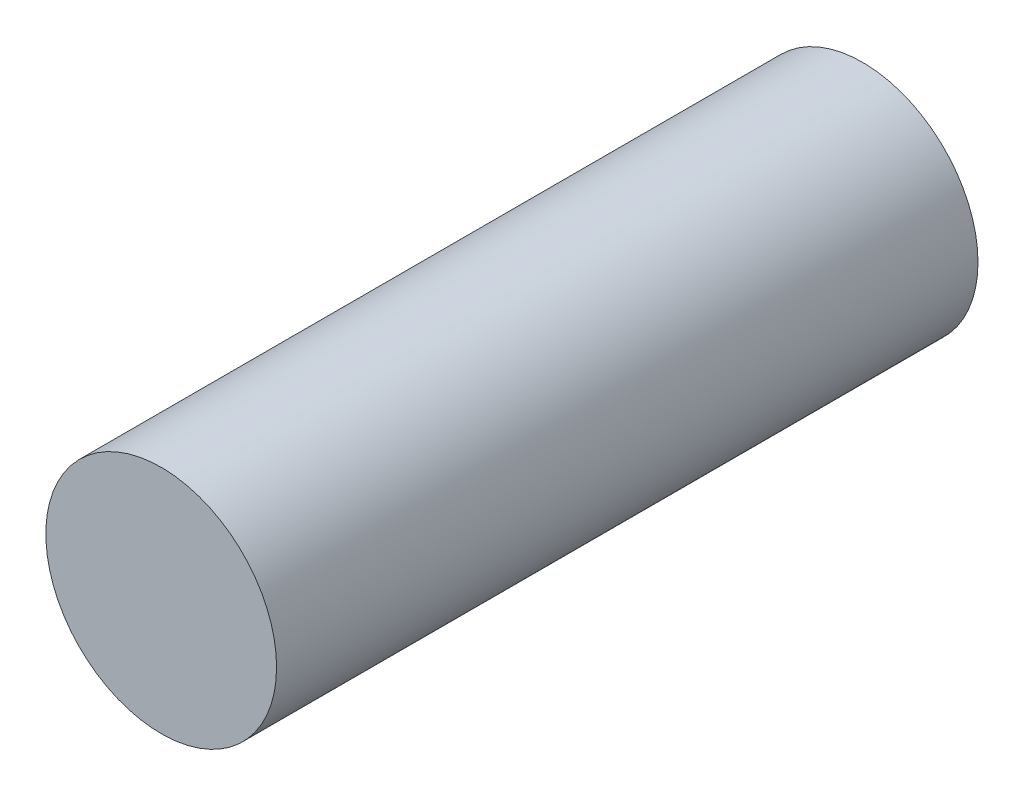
SolidWorks part; units mm, degrees
ref_plane "Front Plane" through (0, 0, 0) normal (0, 0, 1) x (1, 0, 0)
ref_plane "Top Plane" through (0, 0, 0) normal (0, 1, 0) x (1, 0, 0)
ref_plane "Right Plane" through (0, 0, 0) normal (1, 0, 0) x (0, 0, -1)
sketch "Sketch1" plane through (0, 0, 0) normal (0, 0, 1) x (1, 0, 0)
  circle A0 centre (0, 0) radius 3.175
  dimension "D1" = 6.35
extrude "Extrude1" add sketch "Sketch1" along normal blind 19.304
